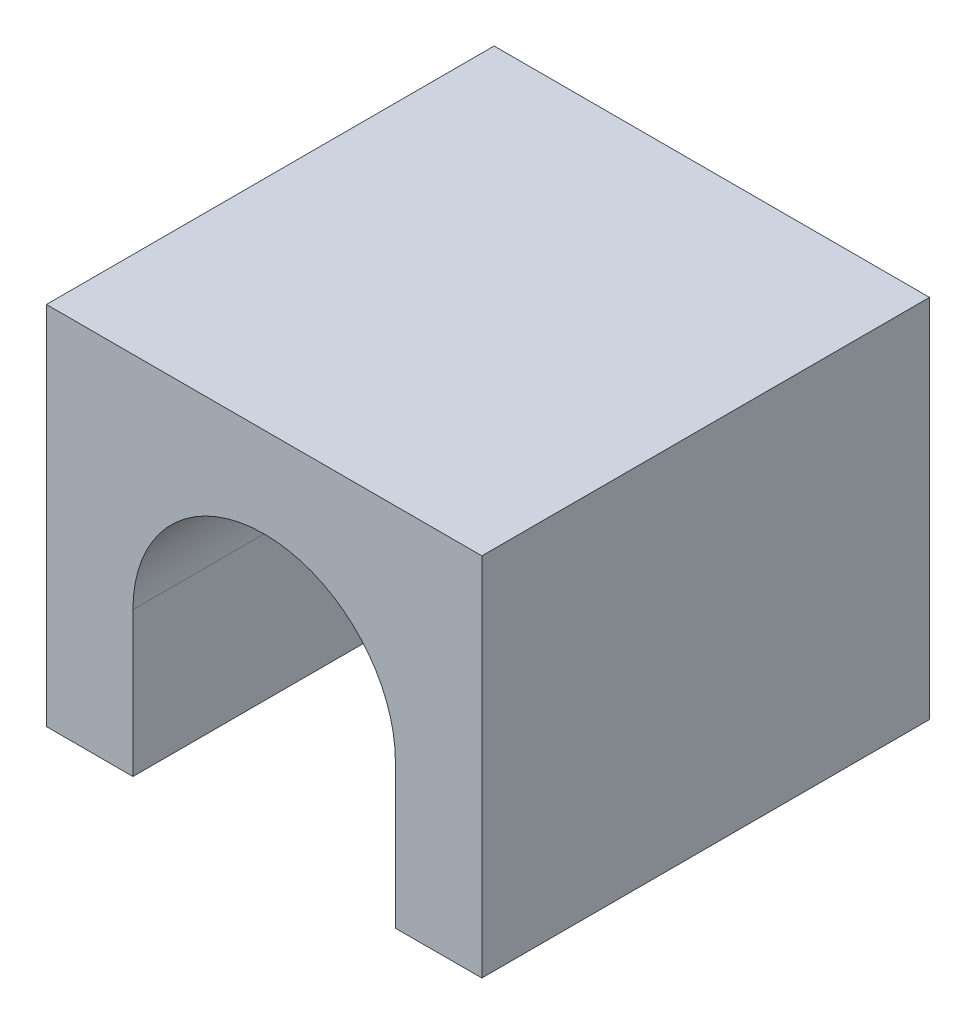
SolidWorks part; units mm, degrees
ref_plane "Front Plane" through (0, 0, 0) normal (0, 0, 1) x (1, 0, 0)
ref_plane "Top Plane" through (0, 0, 0) normal (0, 1, 0) x (1, 0, 0)
ref_plane "Right Plane" through (0, 0, 0) normal (1, 0, 0) x (0, 0, -1)
sketch "Sketch1" plane through (0, 0, 0) normal (0, 0, 1) x (1, 0, 0)
  line L0 (4.0774, -26.5519) -> (14.011, -26.5116)
  line L1 (4.011, -26.5116) -> (4.0774, -26.5519)
  line L2 (4.011, -7.786) -> (4.011, -26.5116)
  line L7 (-42.4008, 20.853) -> (14.011, 20.853)
  line L8 (-42.4008, 20.853) -> (-42.4008, -26.5116)
  line L10 (14.011, 20.853) -> (14.011, -26.5116)
  line L17 (-33.3347, -7.786) -> (-32.4008, -26.5116)
  line L18 (-32.4008, -26.5116) -> (-42.4008, -26.5116)
  arc A0 (4.011, -7.786) -> (-33.3347, -7.786) centre (-14.6619, -7.8199) ccw
  point P5 (-14.1949, -7.786)
  point P6 (-14.1949, 20.853)
  point P8 (-14.6619, 10.853)
  dimension "D5" = 37.3458
  dimension "D1" = 10
  dimension "D2" = 10
  dimension "D6" = 10
extrude "Boss-Extrude1" add sketch "Sketch1" along normal blind 19
sketch "Sketch2" plane through (0, 0, 19) normal (0, 0, 1) x (1, 0, 0)
  line L0 (-14.1949, 10.964) -> (-14.1949, -26.536) construction
  line L1 (4.5551, 10.964) -> (-32.9449, 10.964) construction
  line L2 (-32.9449, -26.536) -> (4.5551, -26.536) construction
  line L3 (4.5551, -7.786) -> (-32.9449, -7.786) construction
  line L4 (4.5551, -26.536) -> (4.5551, 10.964) construction
  line L5 (-32.9449, 10.964) -> (-32.9449, -26.536) construction
  line L6 (-31.1949, -7.786) -> (-31.1949, -24.786)
  line L7 (-42.4008, -26.5116) -> (-31.1949, -26.5116)
  line L8 (2.8051, -7.786) -> (2.8051, -24.786)
  line L9 (-31.1949, -26.5116) -> (-31.1949, -24.786)
  line L11 (-31.1949, 9.214) -> (2.8051, -24.786) construction
  line L12 (-31.1949, -24.786) -> (2.8051, 9.214) construction
  line L17 (-37.9449, 15.964) -> (9.5551, -31.536) construction
  line L18 (-37.9449, -31.536) -> (9.5551, 15.964) construction
  line L22 (2.8051, -26.5317) -> (2.8051, -24.786)
  line L26 (-42.4008, -26.5116) -> (-42.4008, 20.853)
  line L27 (-42.4008, 20.853) -> (14.011, 20.853)
  line L28 (14.011, 20.853) -> (14.011, -26.5116)
  line L29 (14.011, -26.5116) -> (2.8051, -26.5317)
  arc A0 (2.8051, -7.786) -> (-31.1949, -7.786) centre (-14.1949, -7.786) ccw
  point P12 (-14.1949, -7.786)
  point P17 (-14.1949, -7.786)
  dimension "D3" = 34
  dimension "D1" = 34
  dimension "D2" = 34
extrude "Boss-Extrude2" add sketch "Sketch2" along normal blind 39
equation "\"thickness of material\"= 5mm"
